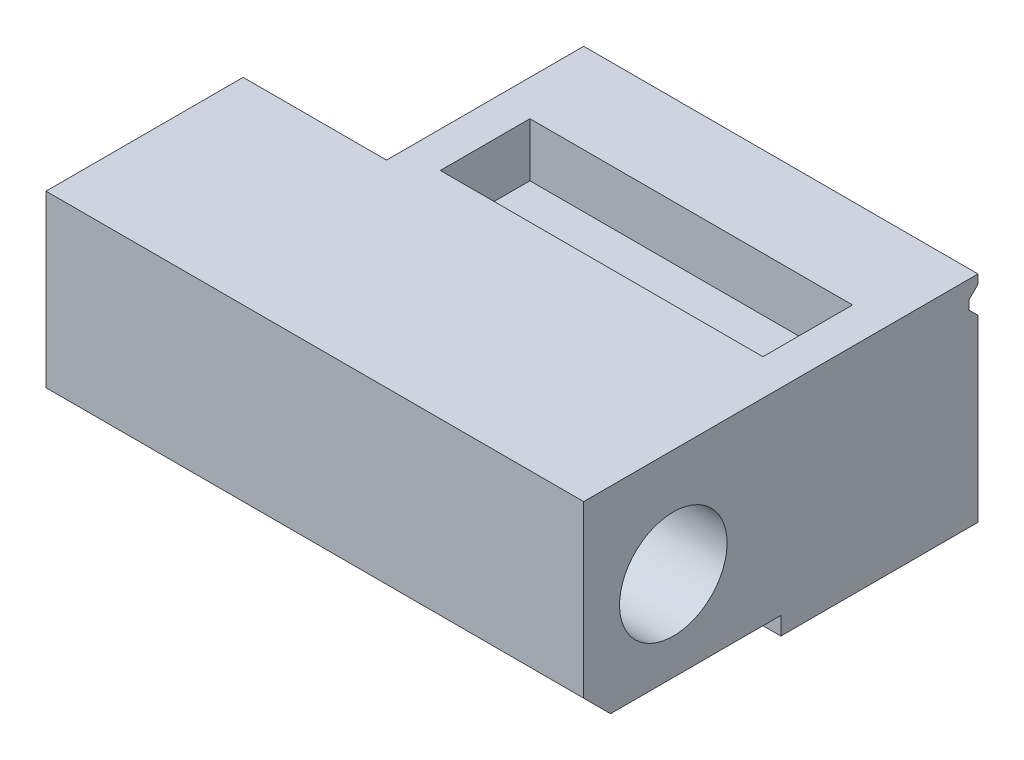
SolidWorks part; units mm, degrees
ref_plane "Face" through (0, 0, 0) normal (0, 0, 1) x (1, 0, 0)
ref_plane "Dessus" through (0, 0, 0) normal (0, 1, 0) x (1, 0, 0)
ref_plane "Droite" through (0, 0, 0) normal (1, 0, 0) x (0, 0, -1)
sketch "Esquisse1" plane through (0, 0, 0) normal (0, 0, 1) x (1, 0, 0)
  line L1 (-220, 60) -> (0, 60)
  line L2 (-220, 60) -> (-220, -60)
  line L3 (-220, -60) -> (0, -60)
  line L4 (0, 60) -> (0, -60)
  dimension "D1" = 220
  dimension "D2" = 120
  dimension "D3" = 60
extrude "Extrusion1" add sketch "Esquisse1" along normal blind 110
sketch "Esquisse2" plane through (0, 0, 110) normal (0, 0, 1) x (1, 0, 0)
  line L1 (-300, 60) -> (0, 60)
  line L2 (-300, 60) -> (-300, -50)
  line L3 (-300, -50) -> (0, -50)
  line L4 (0, 60) -> (0, -50)
  dimension "D1" = 60
  dimension "D2" = 50
  dimension "D3" = 300
extrude "Extrusion2" add sketch "Esquisse2" along normal blind 110
sketch "Esquisse3" plane through (-300, 0, 0) normal (-1, 0, 0) x (0, 0, 1)
  line L0 (110, 5) -> (130, -50)
  line L1 (110, 60) -> (110, -50) construction
  line L2 (220, -50) -> (110, -50) construction
  line L3 (130, -50) -> (110, -50)
  line L4 (110, -50) -> (110, 5)
  dimension "D1" = 20
extrude "Enlèv. mat.-Extru.1" cut sketch "Esquisse3" against normal blind 80
sketch "Esquisse4" plane through (0, -60, 0) normal (0, -1, 0) x (1, 0, 0)
  line L0 (-220, 110) -> (0, 110) construction
  line L1 (-200, 100) -> (-20, 100)
  line L2 (-200, 100) -> (-200, 50)
  line L3 (-200, 50) -> (-20, 50)
  line L4 (-20, 100) -> (-20, 50)
  line L5 (-220, 110) -> (-220, 0) construction
  line L6 (0, 110) -> (0, 0) construction
  dimension "D1" = 50
  dimension "D2" = 10
  dimension "D3" = 20
  dimension "D4" = 20
extrude "Enlèv. mat.-Extru.2" cut sketch "Esquisse4" against normal blind 30
sketch "Esquisse5" plane through (0, 60, 0) normal (0, 1, 0) x (-1, 0, 0)
  line L0 (220, 110) -> (300, 110) construction
  line L1 (20, 100) -> (200, 100)
  line L2 (20, 100) -> (20, 50)
  line L3 (20, 50) -> (200, 50)
  line L4 (200, 100) -> (200, 50)
  line L5 (220, 110) -> (220, 0) construction
  line L6 (0, 220) -> (0, 0) construction
  dimension "D1" = 50
  dimension "D2" = 10
  dimension "D3" = 20
  dimension "D4" = 20
extrude "Enlèv. mat.-Extru.3" cut sketch "Esquisse5" against normal blind 30
chamfer "Chanfrein1" distance 15 angle 45 1 edges at (-150, -50, 220)
sketch "Esquisse6" plane through (0, 0, 0) normal (1, 0, 0) x (0, 0, -1)
  line L0 (0, 0) -> (-235.0047, 0) construction
  line L1 (-170, -92.9875) -> (-170, 129.7088) construction
  line L2 (0, -60) -> (0, 60) construction
  circle A0 centre (-170, 0) radius 30
  dimension "D2" = 60
  dimension "D1" = 170
extrude "Enlèv. mat.-Extru.4" cut sketch "Esquisse6" against normal through all
sketch "Esquisse7" plane through (0, 0, 0) normal (1, 0, 0) x (0, 0, -1)
  line L0 (0, 0) -> (-208.0767, 0) construction
  line L1 (0, 55) -> (-5, 50)
  line L2 (0, -60) -> (0, 60) construction
  line L3 (-5, 50) -> (-5, 45)
  line L4 (-5, 45) -> (0, 40)
  line L5 (0, -40) -> (8.4314, -40)
  line L10 (0, 55) -> (8.4314, 55)
  line L11 (8.4314, 55) -> (8.4314, -40)
  line L14 (0, -40) -> (0, 40)
  dimension "D1" = 40
  dimension "D2" = 5
  dimension "D3" = 5
  dimension "D4" = 5
  dimension "D9" = 40
extrude "Enlèv. mat.-Extru.5" cut sketch "Esquisse7" against normal through all
